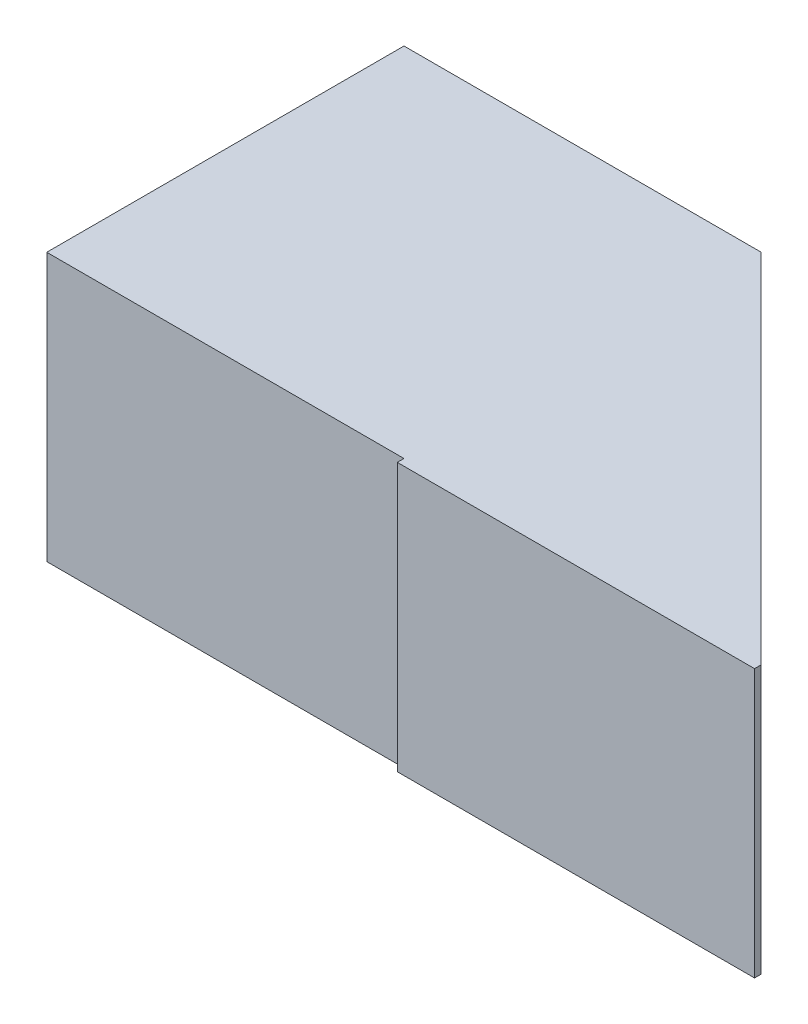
SolidWorks part; units mm, degrees
ref_plane "前视基准面" through (0, 0, 0) normal (0, 0, 1) x (1, 0, 0)
ref_plane "上视基准面" through (0, 0, 0) normal (0, 1, 0) x (1, 0, 0)
ref_plane "右视基准面" through (0, 0, 0) normal (1, 0, 0) x (0, 0, -1)
sketch "草图1" plane through (0, 0, 0) normal (0, 1, 0) x (1, 0, 0)
  line L0 (0, 0) -> (16, 0)
  line L1 (16, 0) -> (8, 8)
  line L2 (8, 8) -> (0, 8)
  line L3 (0, 8) -> (0, 0)
  dimension "D1" = 8
  dimension "D2" = 16
  dimension "D3" = 8
extrude "凸台-拉伸1" add sketch "草图1" along normal blind 6
sketch "草图2" plane through (0, 0, 0) normal (0, 0, 1) x (1, 0, 0)
  line L0 (0, 0) -> (16, 0) construction
  line L1 (16, 6) -> (8, 6)
  line L2 (16, 6) -> (16, 0)
  line L3 (16, 0) -> (8, 0)
  line L4 (8, 6) -> (8, 0)
  dimension "D1" = 8
extrude "凸台-拉伸2" add sketch "草图2" along normal blind 0.15
sketch "草图3" plane through (0, 6, 0) normal (0, 1, 0) x (1, 0, 0)
  line L0 (0, 8) -> (8, 0)
